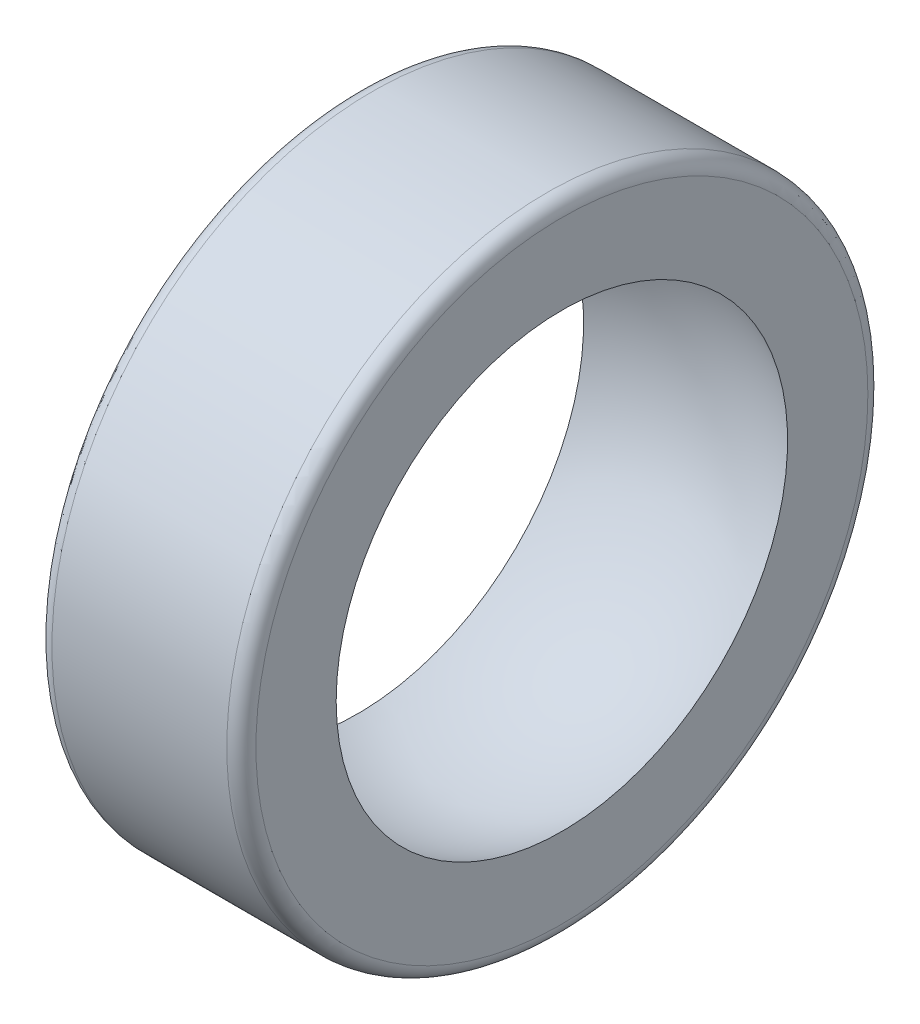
SolidWorks part; units mm, degrees
ref_plane "Plane1" through (0, 0, 0) normal (0, 0, 1) x (1, 0, 0)
ref_plane "Plane2" through (0, 0, 0) normal (0, 1, 0) x (1, 0, 0)
ref_plane "Plane3" through (0, 0, 0) normal (1, 0, 0) x (0, 0, -1)
sketch "Esquisse1" plane through (0, 0, 0) normal (0, 0, 1) x (1, 0, 0)
  line L0 (-60, 0) -> (80, 0) construction
  line L1 (0, 8) -> (0, -30) construction
  line L2 (-3.5, 11) -> (-3.5, 7.746)
  line L3 (-3.5, 11) -> (3.5, 11)
  line L4 (3.5, 11) -> (3.5, 7.746)
  arc A0 (3.5, 7.746) -> (-3.5, 7.746) centre (0, 0) ccw
  point P11 (0, 0)
  point P12 (0, 11)
  dimension "D1" = 17
  dimension "D2" = 11
  dimension "D3" = 3.5
revolve "Base-Révolution" add sketch "Esquisse1" angle 360 about L0
fillet "Congé1" radius 0.5
